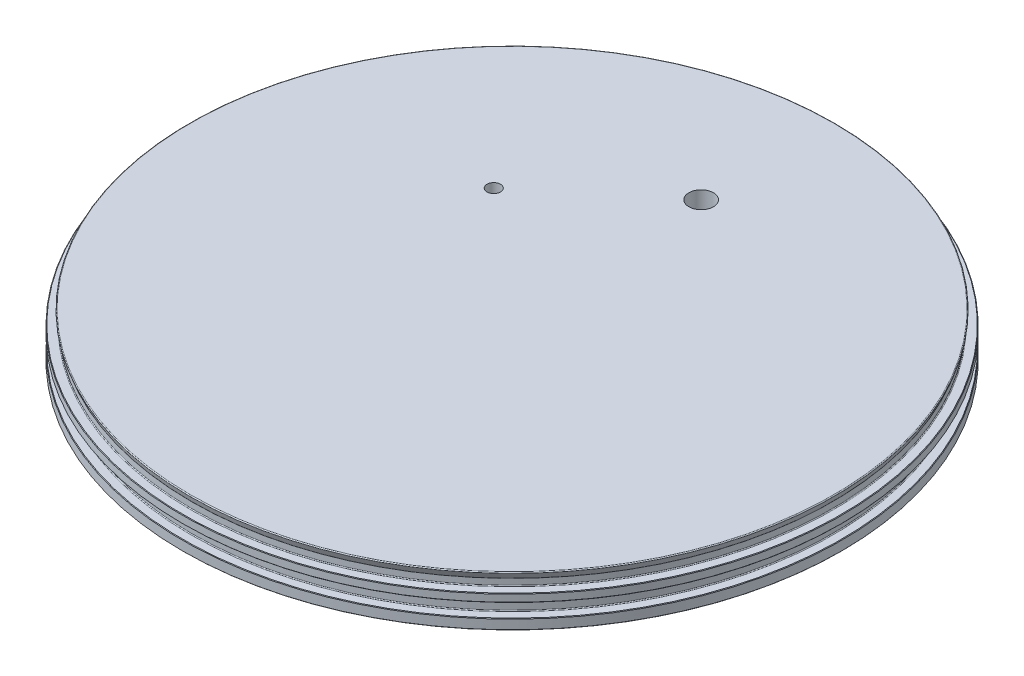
SolidWorks part; units mm, degrees
ref_plane "Front Plane" through (0, 0, 0) normal (0, 0, 1) x (1, 0, 0)
ref_plane "Top Plane" through (0, 0, 0) normal (0, 1, 0) x (1, 0, 0)
ref_plane "Right Plane" through (0, 0, 0) normal (1, 0, 0) x (0, 0, -1)
sketch "Sketch1" plane through (0, 0, 0) normal (0, 0, 1) x (1, 0, 0)
  line L0 (0, 0) -> (0, 54.015) construction
  line L1 (0, 0) -> (-124.46, 0)
  line L2 (-124.46, 0) -> (-124.46, 10.414)
  line L3 (-155.321, 4.5483) -> (-155.321, -2.6637) construction
  line L4 (-154.94, -0.5317) -> (-154.94, 2.7467) construction
  line L5 (-154.94, 15.24) -> (-150.622, 15.24)
  line L6 (-150.622, 15.24) -> (-150.622, 21.59)
  line L7 (-150.622, 21.59) -> (-154.94, 21.59)
  line L8 (-154.94, 21.59) -> (-154.94, 25.4)
  line L9 (-154.94, 25.4) -> (-150.622, 25.4)
  line L10 (-150.622, 25.4) -> (-150.622, 28.575)
  line L11 (-150.622, 28.575) -> (-151.7776, 31.75)
  line L13 (-154.94, 10.414) -> (-154.94, 15.24)
  line L14 (-151.7776, 31.75) -> (0, 31.75)
  line L15 (0, 31.75) -> (0, 0)
  line L16 (-124.46, 10.414) -> (-154.94, 10.414)
  dimension "D8" = 10.414
  dimension "D10" = 3.175
  dimension "D1" = 4.318
  dimension "D2" = 154.94
  dimension "D3" = 3.81
  dimension "D4" = 31.75
  dimension "D5" = 6.35
  dimension "D6" = 10.16
  dimension "D7" = 30.48
  dimension "D9" = 0.381
  dimension "D11" = 20
revolve "Revolve1" add sketch "Sketch1" angle 360 about L0
fillet "Fillet1" radius 0.381 6 edges at (0, 15.24, -150.622) (0, 21.59, -150.622) (0, 28.575, -150.622) (0, 31.75, -151.7776) (0, 25.4, -150.622) (0, 10.414, -124.46)
chamfer "Chamfer1" distance 0.254 angle 45 4 edges at (0, 15.24, -154.94) (0, 10.414, -154.94) (0, 25.4, -154.94) (0, 21.59, -154.94)
hole_wizard "1/4-20 Tapped Hole1" positions "Sketch5" profile "Sketch4" tap size "1/4-20" standard "Ansi Inch"
sketch "Sketch5" plane through (0, 10.414, 0) normal (0, -1, 0) x (1, 0, 0)
  line L0 (17.4625, 0) -> (-17.4625, 0) construction
  circle A0 centre (0, 0) radius 124.46 construction
  point P0 (136.525, 0)
  dimension "D1" = 136.525
sketch "Sketch4" plane through (136.525, 10.414, 0) normal (1, 0, 0) x (0, 0, -1)
  line L0 (0, 0) -> (0, 11.6938)
  line L1 (0, 11.6938) -> (2.5527, 10.16)
  line L2 (2.5527, 10.16) -> (2.5527, 0)
  line L5 (2.5527, 0) -> (0, 0)
  line L10 (0, 11.6938) -> (-2.5527, 10.16) construction
  line L11 (0, -6.35) -> (0, 107.95) construction
  dimension "Tap Drill Dia." = 5.1054
  dimension "Tap Drill Depth" = 10.16
  dimension "Drill Angle" = 118
pattern_circular "CirPattern1" count 6 over 360 about axis through (0, 0, 0) along (0, 1, 0) of "1/4-20 Tapped Hole1"
hole_wizard "thru" positions "Sketch9" profile "Sketch10" hole size "7/16" standard "Ansi Inch"
sketch "Sketch9" plane through (0, 31.75, 0) normal (0, 1, 0) x (-1, 0, 0)
  line L0 (0, 17.4625) -> (0, -17.4625) construction
  point P0 (0, -88.9)
  dimension "D1" = 88.9
sketch "Sketch10" plane through (0, 31.75, -88.9) normal (1, 0, 0) x (0, 0, 1)
  line L0 (0, 0) -> (0, 31.75)
  line L1 (0, 31.75) -> (5.7544, 31.75)
  line L2 (5.7544, 31.75) -> (5.7544, 0)
  line L5 (5.7544, 0) -> (0, 0)
  line L11 (0, -6.35) -> (0, 107.95) construction
  dimension "Thru Hole Dia." = 11.5087
  dimension "Thru Hole Depth" = 31.75
hole_wizard "SAE#4" positions "Sketch21" profile "Sketch31" legacy
sketch "Sketch21" plane through (-69.9025, 0, 88.9111) normal (0, -1, 0) x (1, 0, 0)
  line L0 (16.3943, -133.8098) -> (69.9025, -88.9111) construction
  line L1 (69.9025, -88.9111) -> (69.9025, -177.8111) construction
  circle A0 centre (69.9025, -88.9111) radius 69.85 construction
  point P0 (16.3943, -133.8098)
  dimension "D1" = 139.7
  dimension "D2" = 50
sketch "Sketch31" plane through (-53.5082, 0, -44.8987) normal (1, 0, 0) x (0, 0, -1)
  line L0 (0, 0) -> (0, 18.034)
  line L1 (0, 18.034) -> (4.9606, 18.034)
  line L2 (4.9606, 18.034) -> (4.9606, 3.0844)
  line L3 (5.6828, 2.3622) -> (6.1849, 0)
  line L4 (6.1849, 0) -> (0, 0)
  line L5 (0, -6.4453) -> (0, 42.3633) construction
  line L6 (-5.5563, 2.9576) -> (-6.1849, 0) construction
  line L7 (4.9606, 3.0844) -> (5.6828, 2.3622)
  line L8 (-169.3587, 0) -> (79.5613, 0) construction
  dimension "Diameter" = 9.9212
  dimension "Depth" = 18.034
  dimension "C-Sink Angle" = 24
  dimension "C-Sink Diameter" = 12.3698
other "SAE#4-Port<1>"
hole_wizard "1/4 (0.25) Diameter Hole2" positions "Sketch33" profile "Sketch32" hole size "1/4" standard "Ansi Inch"
sketch "Sketch33" plane through (0, 0, 0) normal (0, -1, 0) x (1, 0, 0)
  circle A0 centre (-53.5082, -44.8987) radius 6.1849 construction
  point P0 (-53.5082, -44.8987)
sketch "Sketch32" plane through (-53.5082, 0, -44.8987) normal (1, 0, 0) x (0, 0, -1)
  line L0 (0, 0) -> (0, 31.75)
  line L1 (0, 31.75) -> (3.175, 31.75)
  line L2 (3.175, 31.75) -> (3.175, 0)
  line L5 (3.175, 0) -> (0, 0)
  line L11 (0, -6.35) -> (0, 107.95) construction
  dimension "Thru Hole Dia." = 6.35
  dimension "Thru Hole Depth" = 31.75
sketch "Sketch34" [suppressed] plane through (0, 31.75, 0) normal (0, 1, 0) x (1, 0, 0)
  circle A0 centre (0, 85.725) radius 7.239
  dimension "D1" = 14.478
extrude "Cut-Extrude1" [suppressed] cut sketch "Sketch34" against normal blind 20.32
hole_wizard "1/4-20 Tapped Hole2" positions "Sketch36" profile "Sketch35" tap size "1/4-20" standard "Ansi Inch"
sketch "Sketch36" [suppressed] plane through (0, 0, 0) normal (0, -1, 0) x (1, 0, 0)
  line L0 (37.3623, -74.4957) -> (79.5418, 24.8728) construction
  line L1 (79.5418, 24.8728) -> (-37.3623, 74.4957) construction
  line L2 (-37.3623, 74.4957) -> (-79.5418, -24.8728) construction
  line L3 (-79.5418, -24.8728) -> (37.3623, -74.4957) construction
  line L5 (37.3623, -74.4957) -> (-37.3623, 74.4957) construction
  line L9 (0, 0) -> (-53.5082, -44.8987) construction
  line L11 (0, 0) -> (0, -85.725) construction
  line L13 (0, 0) -> (-26.4696, -62.3585) construction
  arc A0 (-53.5082, -44.8987) -> (0, -69.85) centre (0, 0) ccw construction
  point P0 (37.3623, -74.4957)
  point P1 (79.5418, 24.8728)
  point P3 (-37.3623, 74.4957)
  point P5 (-79.5418, -24.8728)
  dimension "D1" = 107.95
  dimension "D2" = 127
  dimension "D3" = 27
sketch "Sketch35" plane through (37.3623, 0, -74.4957) normal (1, 0, 0) x (0, 0, -1)
  line L0 (0, 0) -> (0, 18.0438)
  line L1 (0, 18.0438) -> (2.5527, 16.51)
  line L2 (2.5527, 16.51) -> (2.5527, 0)
  line L5 (2.5527, 0) -> (0, 0)
  line L10 (0, 18.0438) -> (-2.5527, 16.51) construction
  line L11 (0, -6.35) -> (0, 107.95) construction
  dimension "Tap Drill Dia." = 5.1054
  dimension "Tap Drill Depth" = 16.51
  dimension "Drill Angle" = 118
hole_wizard "#6-32 Tapped Hole1" positions "Sketch38" profile "Sketch37" tap size "#6-32" standard "Ansi Inch"
sketch "Sketch38" [suppressed] plane through (0, 31.75, 0) normal (0, 1, 0) x (-1, 0, 0)
  line L1 (43.18, 62.23) -> (-43.18, 62.23) construction
  line L2 (-43.18, 62.23) -> (-43.18, -62.23) construction
  line L3 (-43.18, -62.23) -> (43.18, -62.23) construction
  line L4 (43.18, -62.23) -> (43.18, 62.23) construction
  line L6 (0, 0) -> (-43.18, -62.23) construction
  line L8 (0, 0) -> (43.18, 62.23) construction
  line L10 (0, 0) -> (0, -85.725) construction
  point P0 (-43.18, -62.23)
  point P1 (-43.18, 62.23)
  point P3 (43.18, 62.23)
  point P5 (43.18, -62.23)
  dimension "D1" = 86.36
  dimension "D2" = 124.46
sketch "Sketch37" plane through (43.18, 31.75, -62.23) normal (1, 0, 0) x (0, 0, 1)
  line L0 (0, 0) -> (0, 10.2107)
  line L1 (0, 10.2107) -> (1.3525, 9.398)
  line L2 (1.3525, 9.398) -> (1.3525, 0)
  line L5 (1.3525, 0) -> (0, 0)
  line L10 (0, 10.2107) -> (-1.3526, 9.398) construction
  line L11 (0, -6.35) -> (0, 107.95) construction
  dimension "Tap Drill Dia." = 2.7051
  dimension "Tap Drill Depth" = 9.398
  dimension "Drill Angle" = 118
hole_wizard "1/4-20 Tapped Hole3" positions "Sketch40" profile "Sketch39" tap size "1/4-20" standard "Ansi Inch"
sketch "Sketch40" [suppressed] plane through (0, 31.75, 0) normal (0, 1, 0) x (-1, 0, 0)
  line L0 (62.23, -62.23) -> (-62.23, -62.23) construction
  line L1 (-62.23, -62.23) -> (-62.23, 62.23) construction
  line L2 (-62.23, 62.23) -> (62.23, 62.23) construction
  line L3 (62.23, 62.23) -> (62.23, -62.23) construction
  line L5 (62.23, 62.23) -> (0, 0) construction
  line L6 (0, 0) -> (-62.23, -62.23) construction
  point P0 (62.23, -62.23)
  point P1 (-62.23, -62.23)
  point P3 (-62.23, 62.23)
  point P5 (62.23, 62.23)
  dimension "D1" = 124.46
sketch "Sketch39" plane through (-62.23, 31.75, -62.23) normal (1, 0, 0) x (0, 0, 1)
  line L0 (0, 0) -> (0, 14.2338)
  line L1 (0, 14.2338) -> (2.5527, 12.7)
  line L2 (2.5527, 12.7) -> (2.5527, 0)
  line L5 (2.5527, 0) -> (0, 0)
  line L10 (0, 14.2338) -> (-2.5527, 12.7) construction
  line L11 (0, -6.35) -> (0, 107.95) construction
  dimension "Tap Drill Dia." = 5.1054
  dimension "Tap Drill Depth" = 12.7
  dimension "Drill Angle" = 118
sketch "Sketch41" [suppressed] plane through (0, 0, 0) normal (0, -1, 0) x (1, 0, 0)
  line L0 (-53.5082, -44.8987) -> (0, 0) construction
  line L1 (0, 0) -> (53.5082, 44.8987) construction
  circle A0 centre (53.5082, 44.8987) radius 11.1125
  dimension "D1" = 22.225
extrude "Cut-Extrude2" [suppressed] cut sketch "Sketch41" against normal blind 1.016
sketch "Sketch42" [suppressed] plane through (0, 1.016, 0) normal (0, -1, 0) x (1, 0, 0)
  circle A0 centre (53.5082, 44.8987) radius 7.1501
  dimension "D1" = 14.3002
extrude "Cut-Extrude3" [suppressed] cut sketch "Sketch42" against normal blind 2.032
hole_wizard " (0.25) Diameter Hole1" positions "Sketch44" profile "Sketch43" hole size "11/64" standard "Ansi Inch"
sketch "Sketch44" [suppressed] plane through (0, 3.048, 0) normal (0, -1, 0) x (1, 0, 0)
  circle A0 centre (53.5082, 44.8987) radius 7.1501 construction
  point P0 (53.5082, 44.8987)
sketch "Sketch43" plane through (53.5082, 3.048, 44.8987) normal (1, 0, 0) x (0, 0, -1)
  line L0 (0, 0) -> (0, 28.702)
  line L1 (0, 28.702) -> (3.175, 28.702)
  line L2 (3.175, 28.702) -> (3.175, 0)
  line L5 (3.175, 0) -> (0, 0)
  line L11 (0, -6.35) -> (0, 107.95) construction
  dimension "Thru Hole Dia." = 4.3658
  dimension "Thru Hole Depth" = 12.065
hole_wizard "33/64 (0.51563) Diameter Hole1" positions "Sketch46" profile "Sketch45" hole size "33/64" standard "Ansi Inch"
sketch "Sketch46" [suppressed] plane through (0, 3.048, 0) normal (0, -1, 0) x (1, 0, 0)
  circle A0 centre (53.5082, 44.8987) radius 3.175 construction
  point P0 (53.5082, 44.8987)
sketch "Sketch45" plane through (53.5082, 3.048, 44.8987) normal (1, 0, 0) x (0, 0, -1)
  line L0 (0, 0) -> (0, 16.7368)
  line L1 (0, 16.7368) -> (6.7183, 12.7)
  line L2 (6.7183, 12.7) -> (6.7183, 0)
  line L5 (6.7183, 0) -> (0, 0)
  line L10 (0, 16.7368) -> (-6.7183, 12.7) construction
  line L11 (0, -6.35) -> (0, 107.95) construction
  dimension "Hole Dia." = 13.4366
  dimension "Hole Depth" = 12.7
  dimension "Drill Angle" = 118
hole_wizard "9/16 (0.5625) Diameter Hole2" positions "Sketch48" profile "Sketch47" hole size "9/16" standard "Ansi Inch"
sketch "Sketch48" [suppressed] plane through (0, 3.048, 0) normal (0, -1, 0) x (1, 0, 0)
  circle A0 centre (53.5082, 44.8987) radius 6.7183 construction
  point P0 (53.5082, 44.8987)
sketch "Sketch47" plane through (53.5082, 3.048, 44.8987) normal (1, 0, 0) x (0, 0, -1)
  line L0 (0, 0) -> (0, 13.1824)
  line L1 (0, 13.1824) -> (7.1437, 8.89)
  line L2 (7.1437, 8.89) -> (7.1437, 0)
  line L5 (7.1437, 0) -> (0, 0)
  line L10 (0, 13.1824) -> (-7.1438, 8.89) construction
  line L11 (0, -6.35) -> (0, 107.95) construction
  dimension "Hole Dia." = 14.2875
  dimension "Hole Depth" = 8.89
  dimension "Drill Angle" = 118
sketch "Sketch49" plane through (0, 0, 0) normal (0, -1, 0) x (1, 0, 0)
  circle A0 centre (0, -88.9) radius 11.1125
  dimension "D1" = 22.225
extrude "Cut-Extrude4" [suppressed] cut sketch "Sketch49" against normal blind 0.254
